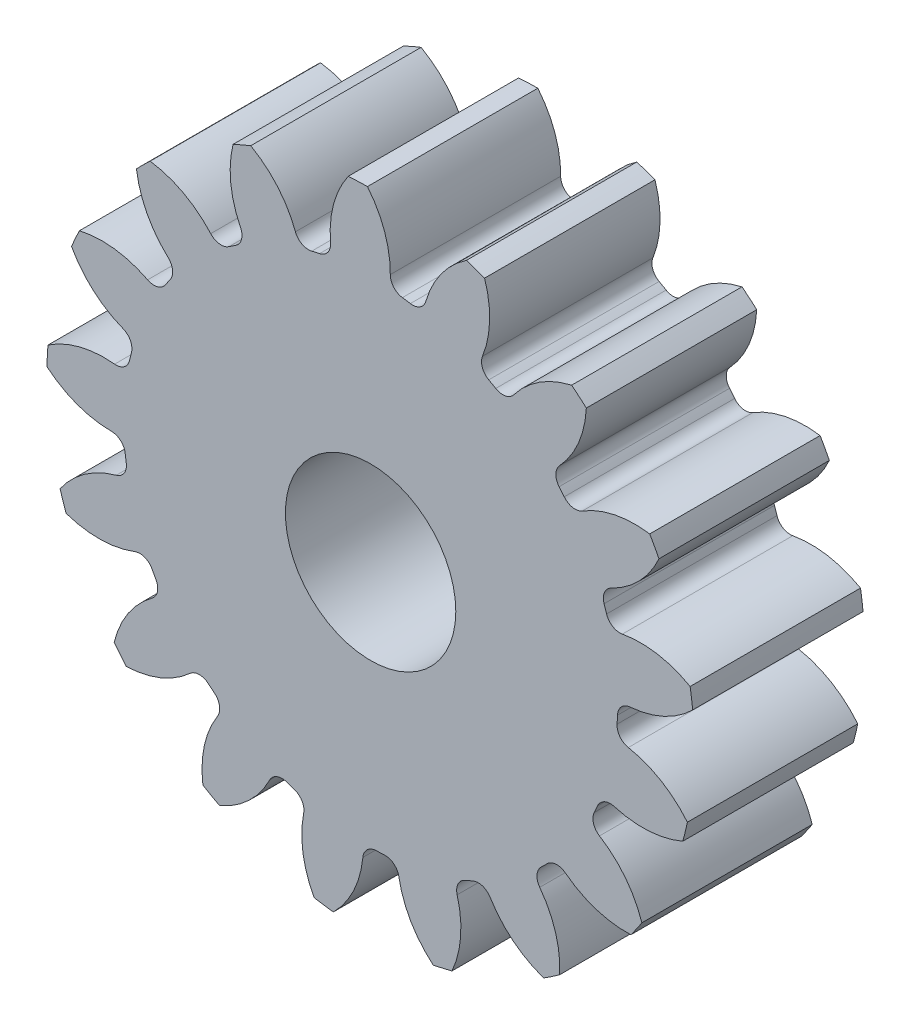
SolidWorks part; units mm, degrees
ref_plane "Front" through (0, 0, 0) normal (0, 0, 1) x (1, 0, 0)
ref_plane "Top" through (0, 0, 0) normal (0, 1, 0) x (1, 0, 0)
ref_plane "Right" through (0, 0, 0) normal (1, 0, 0) x (0, 0, -1)
sketch "Sketch3" plane through (0, 0, 0) normal (0, 0, 1) x (1, 0, 0)
  circle A0 centre (0, 0) radius 193.04
  dimension "od" = 386.08
extrude "gearBody" add sketch "Sketch3" along normal blind 101.6
sketch "Sketch2" plane through (0, 0, 0) normal (0, 0, 1) x (1, 0, 0)
  line L0 (0, 0) -> (149.9491, 62.1109) construction
  line L1 (189.7774, -40.9624) -> (0, 0) construction
  line L2 (0, 0) -> (36.3143, 0) construction
  line L3 (172.5858, 6.808) -> (170.9041, -24.9795) construction
  line L5 (171.745, -9.0857) -> (0, 0) construction
  line L7 (0, 0) -> (162.3037, 0) construction
  arc A0 (162.263, 3.637) -> (160.9735, -20.737) centre (0, 0) ccw construction
  arc A1 (192.0334, 19.6876) -> (188.8843, -39.8391) centre (0, 0) ccw construction
  arc A2 (172.5858, 6.808) -> (170.9041, -24.9795) centre (0, 0) ccw construction
  arc A3 (146.9681, -10.1758) -> (147.2215, -5.3876) centre (0, 0) ccw
  arc A4 (189.7774, -40.9624) -> (153.6795, -18.8728) centre (142.5588, -77.5853) ccw
  arc A5 (189.7774, -40.9624) -> (193.04, 20.7104) centre (0, 0) ccw
  arc A6 (193.04, 20.7104) -> (154.813, 2.5528) centre (149.9491, 62.1109) cw
  arc A7 (147.2215, -5.3876) -> (154.813, 2.5528) centre (155.4862, -5.69) cw
  arc A8 (153.6795, -18.8728) -> (146.9681, -10.1758) centre (155.2186, -10.747) cw
  point P6 (193.04, 20.7104)
  point P22 (189.7774, -40.9624)
  dimension "baseDia" = 324.6074
  dimension "od" = 386.08
  dimension "pd" = 345.44
  dimension "rd" = 294.64
  dimension "rFillet" = 8.2702
  dimension "pointX" = 193.04
  dimension "pointY" = 20.7104
  dimension "CTT" = 31.7875
  dimension "flankCenterAngle" = 22.5
extrude "toothCut" cut sketch "Sketch2" along normal through all
pattern_circular "CirPattern1" count 17 over 360 about axis through (0, 0, 0) along (0, 0, 1) of "toothCut"
sketch "hub1Dia" plane through (0, 0, 0) normal (0, 0, -1) x (-1, 0, 0)
  circle A0 centre (0, 0) radius 12.7
  dimension "hub1Dia" = 25.4
sketch "hub2Dia" plane through (0, 0, 101.6) normal (0, 0, 1) x (1, 0, 0)
  circle A0 centre (0, 0) radius 12.7
  dimension "hub2dia" = 25.4
sketch "boreDia" plane through (0, 0, 0) normal (0, 0, 1) x (1, 0, 0)
  circle A0 centre (0, 0) radius 50.8
  dimension "boreDia" = 101.6
extrude "bore" cut sketch "boreDia" against normal mid plane 25400
